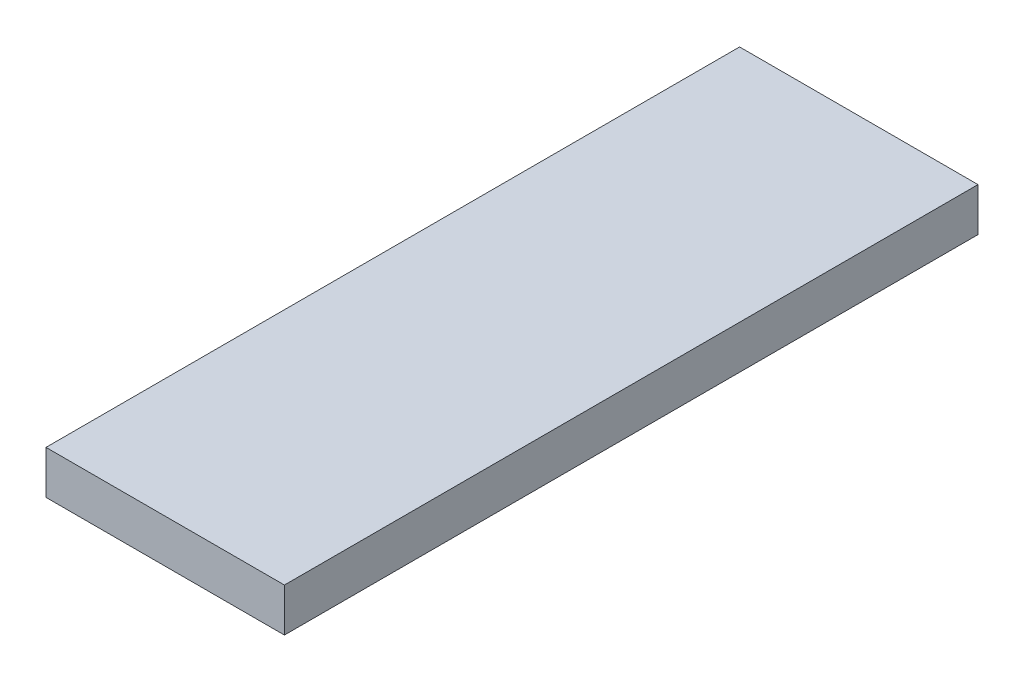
SolidWorks part; units mm, degrees
ref_plane "Front Plane" through (0, 0, 0) normal (0, 0, 1) x (1, 0, 0)
ref_plane "Top Plane" through (0, 0, 0) normal (0, 1, 0) x (1, 0, 0)
ref_plane "Right Plane" through (0, 0, 0) normal (1, 0, 0) x (0, 0, -1)
sketch "Sketch2" plane through (0, 0, 0) normal (0, 1, 0) x (1, 0, 0)
  line L1 (0, 0) -> (55, 0)
  line L2 (0, 0) -> (0, 160)
  line L3 (0, 160) -> (55, 160)
  line L4 (55, 0) -> (55, 160)
  dimension "D1" = 55
  dimension "D2" = 160
extrude "Boss-Extrude1" add sketch "Sketch2" along normal blind 10
